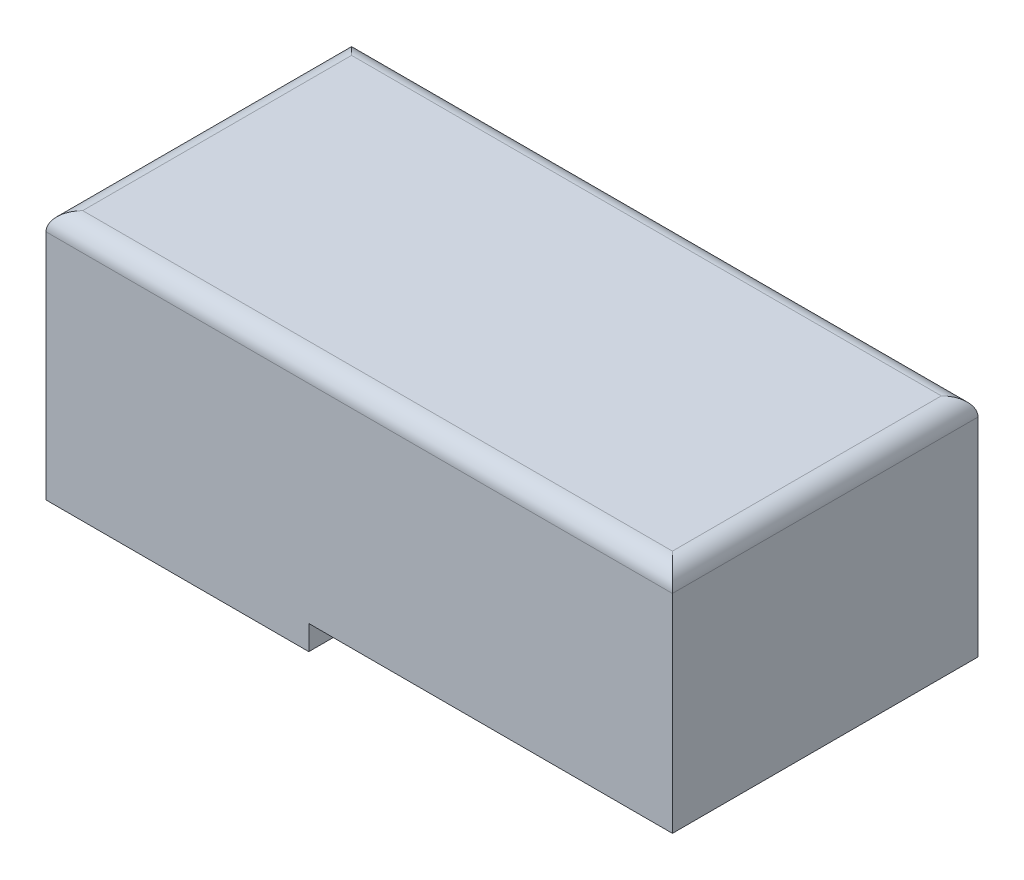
SolidWorks part; units mm, degrees
ref_plane "前视基准面" through (0, 0, 0) normal (0, 0, 1) x (1, 0, 0)
ref_plane "上视基准面" through (0, 0, 0) normal (0, 1, 0) x (1, 0, 0)
ref_plane "右视基准面" through (0, 0, 0) normal (1, 0, 0) x (0, 0, -1)
sketch "草图1" plane through (0, 0, 0) normal (0, 0, 1) x (1, 0, 0)
  line L0 (-92.0332, -4) -> (-92.0332, 8)
  line L1 (-92.0332, 8) -> (13.4668, 8)
  line L2 (13.4668, 8) -> (13.4668, 0)
  line L3 (13.4668, 0) -> (-49.0332, 0)
  line L4 (-49.0332, 0) -> (-49.0332, -4)
  line L5 (-49.0332, -4) -> (-92.0332, -4)
  dimension "D1" = 105.5
  dimension "D2" = 8
  dimension "D3" = 4
  dimension "D4" = 43
extrude "凸台-拉伸1" add sketch "草图1" along normal mid plane 50
sketch "草图2" plane through (0, 8, 0) normal (0, 1, 0) x (1, 0, 0)
  line L0 (-92.0332, -25) -> (-92.0332, 25) construction
  circle A0 centre (-71.0332, 0) radius 7.5
  dimension "D1" = 21
  dimension "D2" = 15
extrude "切除-拉伸1" cut sketch "草图2" against normal through all
sketch "草图5" plane through (0, 8, 0) normal (0, 1, 0) x (1, 0, 0)
  line L0 (-17.5332, 0) -> (-7.5332, 0) construction
  line L1 (-17.5332, 5) -> (-7.5332, 5)
  line L2 (-17.5332, -5) -> (-7.5332, -5)
  line L9 (-36.0311, 0) -> (16.1407, 0) construction
  arc A0 (-17.5332, 5) -> (-17.5332, -5) centre (-17.5332, 0) ccw
  arc A1 (-7.5332, -5) -> (-7.5332, 5) centre (-7.5332, 0) ccw
  circle A2 centre (-71.0332, 0) radius 7.5 construction
  circle A3 centre (-71.0332, 0) radius 7.5
  point P3 (-12.5332, 0)
  dimension "D1" = 5
  dimension "D2" = 10
  dimension "D3" = 58.5
extrude "切除-拉伸2" cut sketch "草图5" against normal through all
sketch "草图10" plane through (0, 8, 0) normal (0, 1, 0) x (1, 0, 0)
  line L0 (13.4668, -25) -> (-92.0332, -25) construction
  line L1 (13.4668, 25) -> (10.4668, 25)
  line L2 (13.4668, 25) -> (13.4668, -25)
  line L3 (13.4668, -25) -> (10.4668, -25)
  line L4 (10.4668, 25) -> (10.4668, -25)
  dimension "D1" = 3
extrude "切除-拉伸4" cut sketch "草图10" against normal through all
sketch "草图11" plane through (0, 8, 0) normal (0, 1, 0) x (1, 0, 0)
  line L1 (-92.0332, -25) -> (10.4668, -25)
  line L2 (-92.0332, -25) -> (-92.0332, 25)
  line L3 (-92.0332, 25) -> (10.4668, 25)
  line L4 (10.4668, -25) -> (10.4668, 25)
extrude "凸台-拉伸2" add sketch "草图11" along normal blind 29
fillet "圆角1" radius 3 4 edges at (-40.7832, 37, 25) (10.4668, 37, 0) (-40.7832, 37, -25) (-92.0332, 37, 0)
